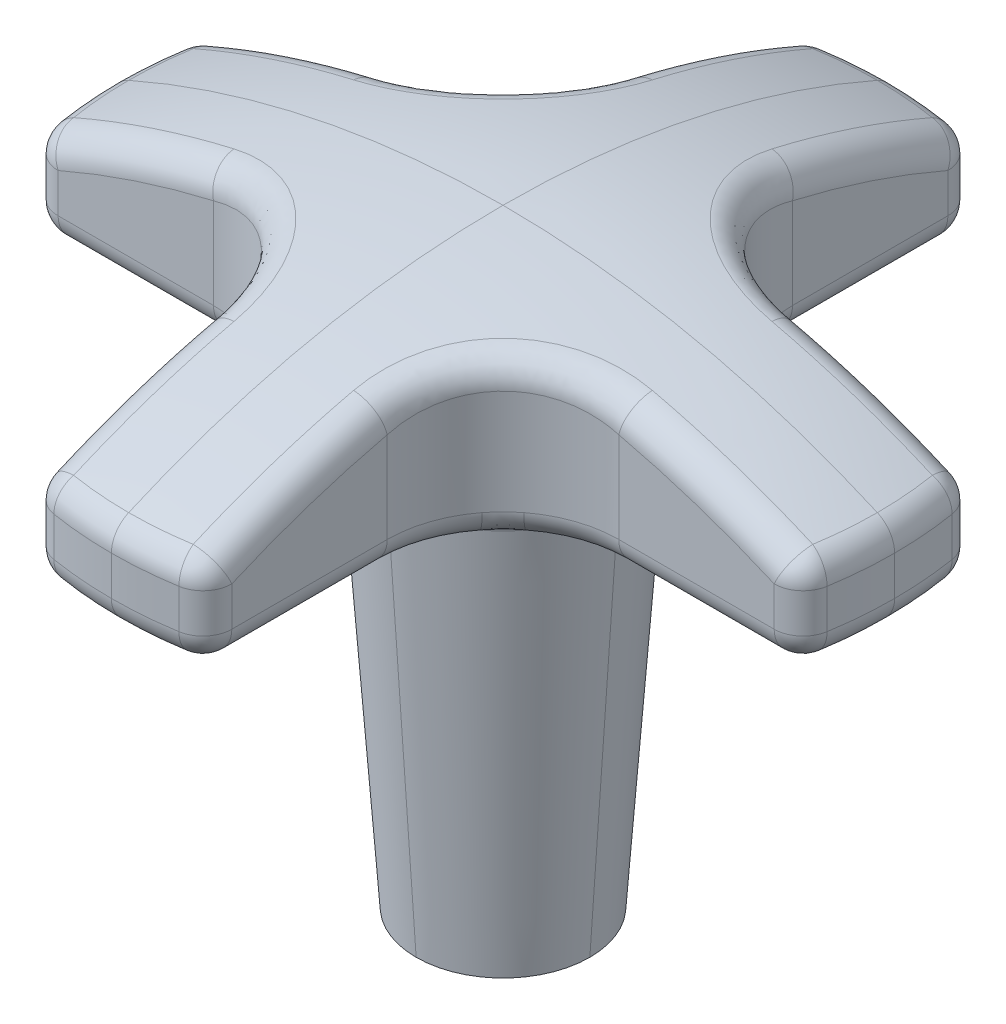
SolidWorks part; units mm, degrees
ref_plane "Front Plane" through (0, 0, 0) normal (0, 0, 1) x (1, 0, 0)
ref_plane "Top Plane" through (0, 0, 0) normal (0, 1, 0) x (1, 0, 0)
ref_plane "Right Plane" through (0, 0, 0) normal (1, 0, 0) x (0, 0, -1)
sketch "Sketch1" plane through (0, 0, 0) normal (0, 0, 1) x (1, 0, 0)
  line L0 (0, 0) -> (0, 164.1076) construction
  line L1 (15, 0) -> (19.9193, 70.3488)
  line L2 (24.9071, 75) -> (62.6387, 75)
  line L3 (67.6387, 80) -> (67.6387, 86.7794)
  arc A0 (64.6594, 91.3529) -> (0, 105) centre (0, -55) ccw
  arc A1 (62.6387, 75) -> (67.6387, 80) centre (62.6387, 80) ccw
  arc A2 (67.6387, 86.7794) -> (64.6594, 91.3529) centre (62.6387, 86.7794) ccw
  arc A3 (19.9193, 70.3488) -> (24.9071, 75) centre (24.9071, 70) cw
  point P11 (67.6387, 75)
  point P14 (67.6387, 90)
  dimension "D4" = 160
  dimension "D7" = 5
  dimension "D1" = 105
  dimension "D2" = 75
  dimension "D3" = 15
  dimension "D5" = 15
  dimension "D6" = 4
surface "Surface-Revolve1" sketch "Sketch1" parameters "D1"=90
sketch "Sketch2" plane through (0, 0, 0) normal (0, 1, 0) x (1, 0, 0)
  line L0 (15, 75) -> (15, 35)
  line L1 (35, 15) -> (75, 15)
  arc A0 (15, 35) -> (35, 15) centre (35, 35) ccw
  dimension "D1" = 20
  dimension "D2" = 40
  dimension "D3" = 40
  dimension "D4" = 35
  dimension "D5" = 35
surface "Surface-Extrude1" sketch "Sketch2" parameters "D1"=120
surface "Surface-Trim1"
surface "Surface-Trim2"
mirror "Mirror1" about plane through (0, 0, 0) normal (0, 0, 1)
mirror "Mirror2" about plane through (0, 0, 0) normal (1, 0, 0)
surface "Surface-Knit1"
fillet "Fillet1" radius 5 48 edges
